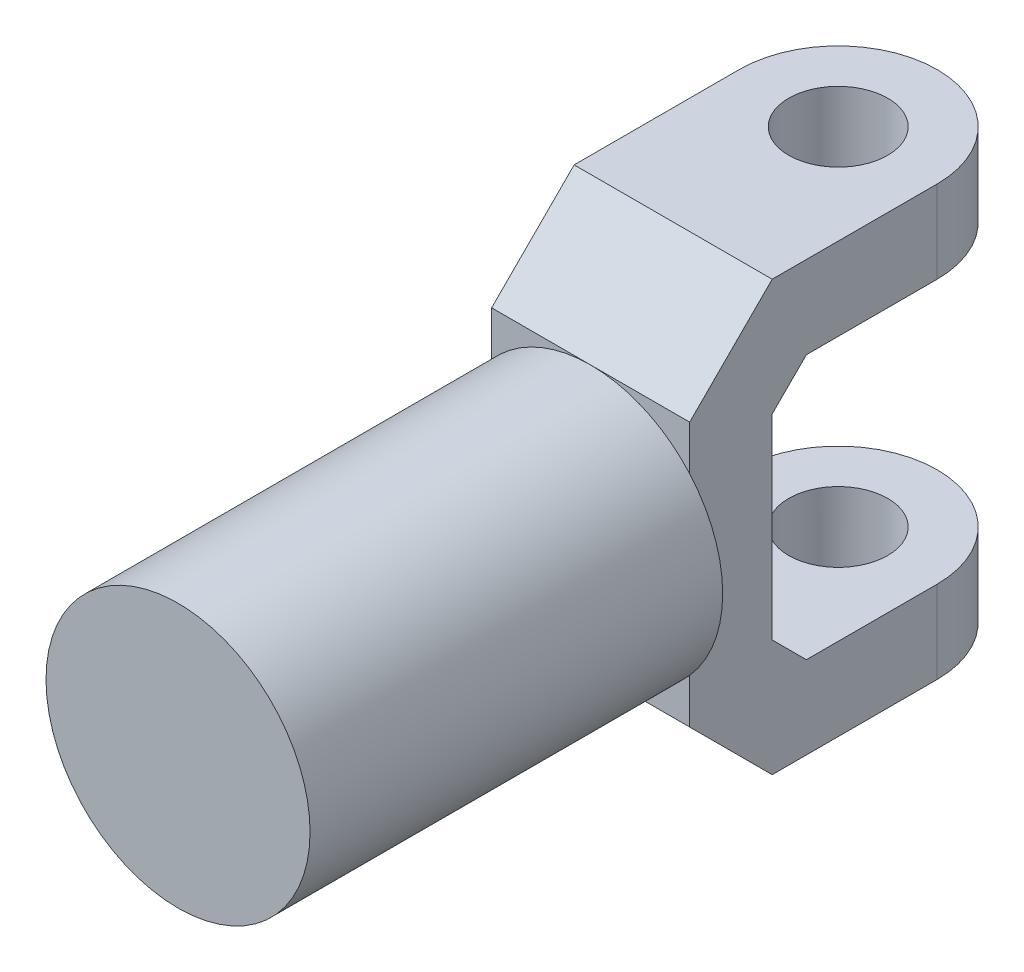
SolidWorks part; units mm, degrees
ref_plane "Front Plane" through (0, 0, 0) normal (0, 0, 1) x (1, 0, 0)
ref_plane "Top Plane" through (0, 0, 0) normal (0, 1, 0) x (1, 0, 0)
ref_plane "Right Plane" through (0, 0, 0) normal (1, 0, 0) x (0, 0, -1)
sketch "Sketch1" plane through (0, 0, 0) normal (0, 0, 1) x (1, 0, 0)
  circle A0 centre (0, 0) radius 40
  dimension "D1" = 80
extrude "Boss-Extrude1" add sketch "Sketch1" along normal blind 125
sketch "Sketch2" plane through (0, 0, 0) normal (1, 0, 0) x (0, 0, -1)
  line L0 (0, -40) -> (0, 40)
  line L1 (0, -40) -> (0, 40) construction
  line L2 (0, 40) -> (25, 65)
  line L3 (25, 65) -> (105, 65)
  line L4 (105, 65) -> (105, 40)
  line L5 (105, 40) -> (35.3553, 40)
  line L6 (35.3553, 40) -> (25, 29.6447)
  line L7 (25, 29.6447) -> (25, -29.6447)
  line L8 (0, 0) -> (25, 0) construction
  line L9 (35.3553, -40) -> (25, -29.6447)
  line L10 (105, -40) -> (35.3553, -40)
  line L11 (105, -65) -> (105, -40)
  line L12 (25, -65) -> (105, -65)
  line L13 (0, -40) -> (25, -65)
  dimension "D1" = 25
  dimension "D2" = 25
  dimension "D3" = 25
  dimension "D4" = 40
  dimension "D5" = 105
  dimension "D6" = 80
extrude "Boss-Extrude2" add sketch "Sketch2" along normal mid plane 60
sketch "Sketch3" plane through (0, 0, 0) normal (0, 1, 0) x (1, 0, 0)
  line L0 (-30, 75) -> (30, 75) construction
  line L3 (30, 105) -> (-30, 105) construction
  line L4 (-30, 105) -> (-30, 25) construction
  line L5 (30, 105) -> (30, 25) construction
  circle A0 centre (0, 75) radius 15
  dimension "D1" = 30
  dimension "D2" = 30
extrude "Cut-Extrude1" cut sketch "Sketch3" against normal through all both and the other way through all
fillet "Fillet1" radius 30 4 edges at (-30, -52.5, -105) (30, -52.5, -105) (-30, 52.5, -105) (30, 52.5, -105)
